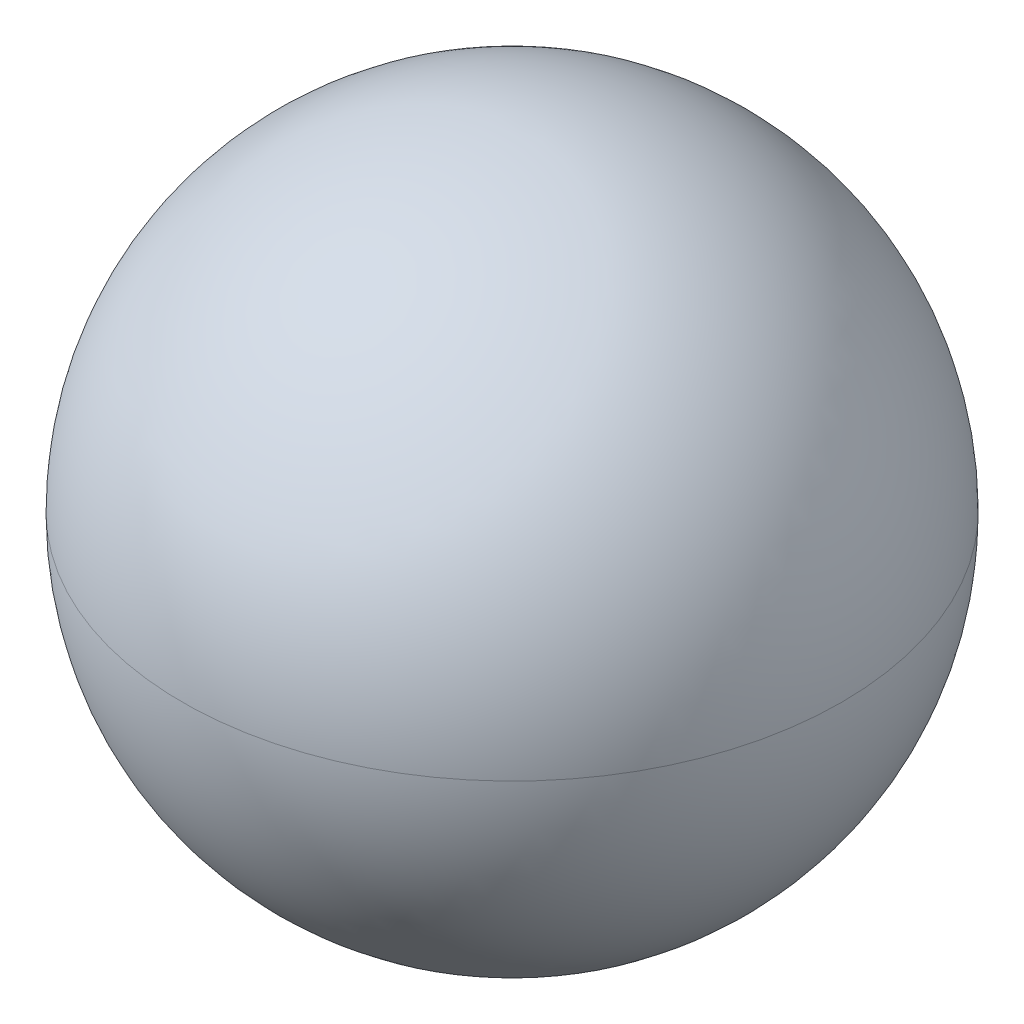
SolidWorks part; units mm, degrees
ref_plane "Front Plane" through (0, 0, 0) normal (0, 0, 1) x (1, 0, 0)
ref_plane "Top Plane" through (0, 0, 0) normal (0, 1, 0) x (1, 0, 0)
ref_plane "Right Plane" through (0, 0, 0) normal (1, 0, 0) x (0, 0, -1)
sketch "Sketch1" plane through (0, 0, 0) normal (0, 0, 1) x (1, 0, 0)
  line L0 (0, 2) -> (0, -2) construction
  line L1 (0, 2) -> (0, -2)
  arc A0 (0, 2) -> (0, -2) centre (0, 0) ccw
  dimension "D1" = 4
revolve "Revolve1" add sketch "Sketch1" angle 360 about L0
sketch "Sketch2" plane through (0, 0, 0) normal (0, 0, 1) x (1, 0, 0)
  circle A0 centre (0, 0) radius 0.75
  dimension "D1" = 1.5
extrude "Cut-Extrude1" cut sketch "Sketch2" against normal up to surface (1.854 mm away)
sketch "Sketch3" plane through (0, 0, 0) normal (0, 1, 0) x (1, 0, 0)
  circle A0 centre (0, 0) radius 2
  dimension "D1" = 4
sketch "Sketch4" plane through (0, 0, 0) normal (0, 0, -1) x (-1, 0, 0)
  line L0 (0, 0) -> (0, 2) construction
  arc A0 (2, 0) -> (-2, 0) centre (0, 0) ccw construction
sketch "Sketch5" plane through (0, 0, 0) normal (0, 0, -1) x (-1, 0, 0)
  circle A0 centre (0, 0) radius 0.5
  dimension "D1" = 1
extrude "Cut-Extrude2" cut sketch "Sketch5" against normal blind 1
